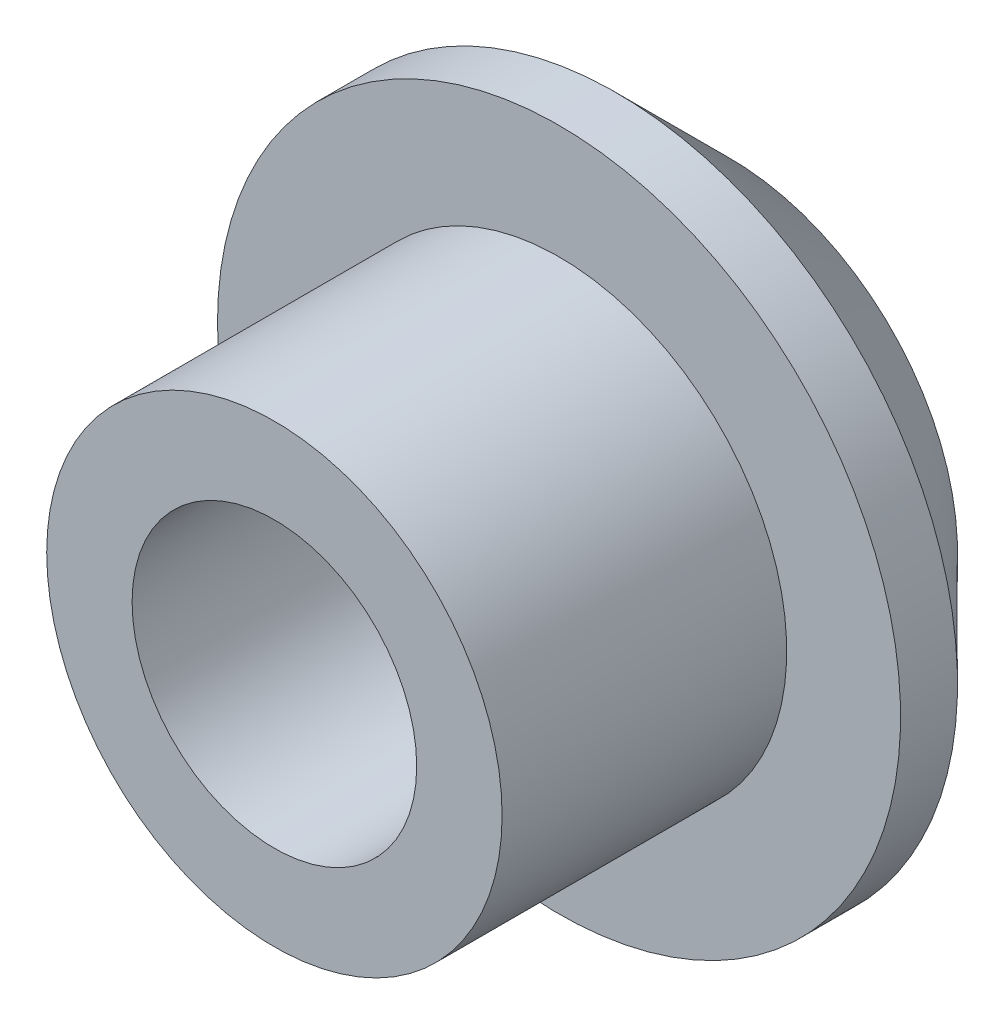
SolidWorks part; units mm, degrees
ref_plane "Front" through (0, 0, 0) normal (0, 0, 1) x (1, 0, 0)
ref_plane "Top" through (0, 0, 0) normal (0, 1, 0) x (1, 0, 0)
ref_plane "Right" through (0, 0, 0) normal (1, 0, 0) x (0, 0, -1)
sketch "Esquisse1" plane through (0, 0, 0) normal (0, 0, 1) x (1, 0, 0)
  circle A0 centre (0, 0) radius 4
  dimension "D1" = 8
extrude "Boss.-Extru.1" add sketch "Esquisse1" along normal blind 5
sketch "Esquisse2" plane through (0, 0, 0) normal (0, 0, -1) x (-1, 0, 0)
  circle A0 centre (0, 0) radius 6
  dimension "D1" = 12
extrude "Boss.-Extru.2" add sketch "Esquisse2" along normal blind 3
hole_wizard "Diamètre du perçage Ø0.15 (0.15)1" positions "Esquisse7" profile "Esquisse6" hole size "Ø0.15" standard "Ansi Metric"
sketch "Esquisse7" plane through (0, 0, -3) normal (0, 0, -1) x (-1, 0, 0)
  point P0 (0, 0)
sketch "Esquisse6" plane through (0, 0, -3) normal (1, 0, 0) x (0, 1, 0)
  line L0 (0, 0) -> (0, 8)
  line L1 (0, 8) -> (2.5, 8)
  line L2 (2.5, 8) -> (2.5, 0)
  line L5 (2.5, 0) -> (0, 0)
  line L11 (0, -6.35) -> (0, 107.95) construction
  dimension "Diamètre du perçage jusqu'au prochain" = 5
  dimension "Profondeur du perçage jusqu'au prochain" = 8
chamfer "Chanfrein1" distance 2 angle 45 1 edges at (-6, 0, -3)
